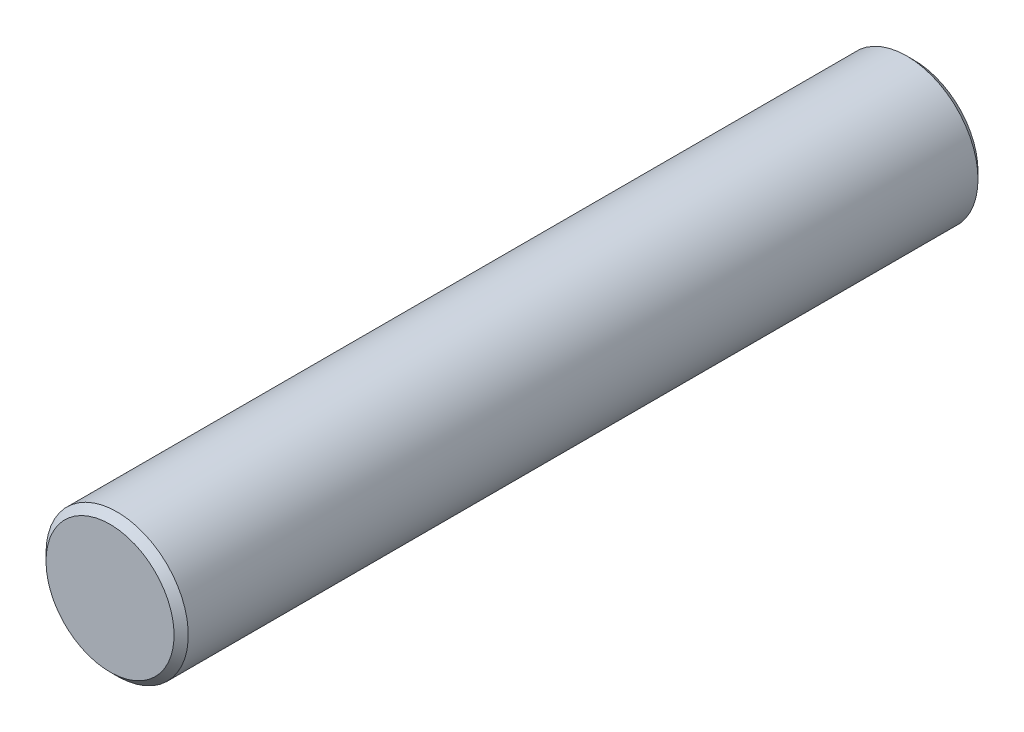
SolidWorks part; units mm, degrees
ref_plane "Plan de face" through (0, 0, 0) normal (0, 0, 1) x (1, 0, 0)
ref_plane "Plan de dessus" through (0, 0, 0) normal (0, 1, 0) x (1, 0, 0)
ref_plane "Plan de droite" through (0, 0, 0) normal (1, 0, 0) x (0, 0, -1)
sketch "Esquisse1" plane through (0, 0, 0) normal (0, 0, 1) x (1, 0, 0)
  circle A0 centre (0, 0) radius 10
  dimension "D1" = 20
extrude "Extrusion1" add sketch "Esquisse1" along normal blind 113
chamfer "Chanfrein1" distance 1 angle 45 2 edges at (10, 0, 0) (10, 0, 113)
